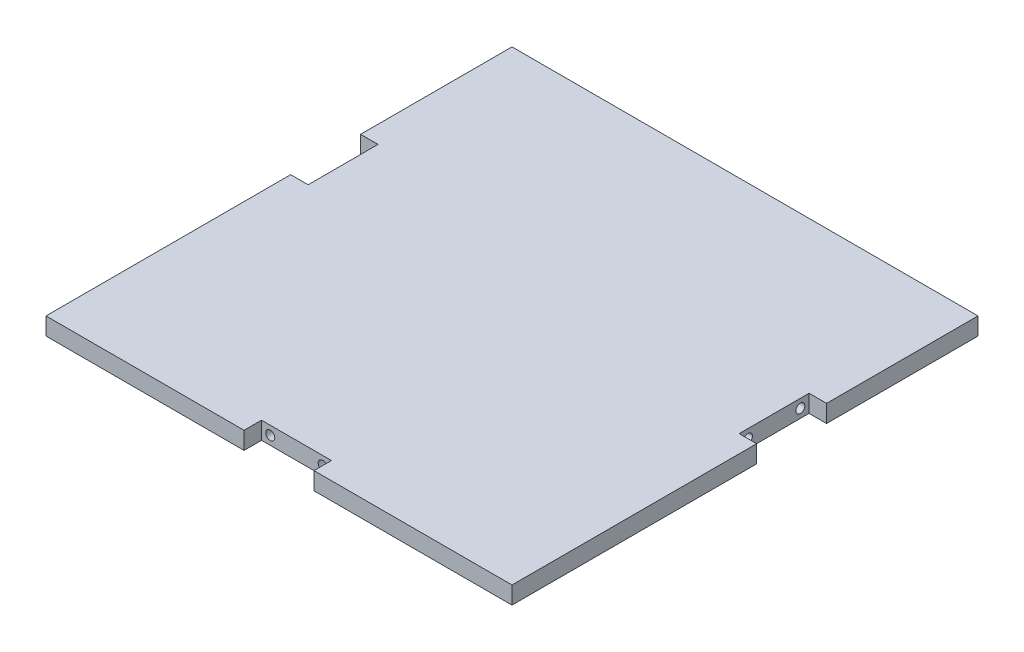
SolidWorks part; units mm, degrees
ref_plane "Front Plane" through (0, 0, 0) normal (0, 0, 1) x (1, 0, 0)
ref_plane "Top Plane" through (0, 0, 0) normal (0, 1, 0) x (1, 0, 0)
ref_plane "Right Plane" through (0, 0, 0) normal (1, 0, 0) x (0, 0, -1)
sketch "Sketch1" plane through (0, 0, 0) normal (0, 1, 0) x (1, 0, 0)
  line L1 (-127, 127) -> (127, 127)
  line L2 (-127, 127) -> (-127, -127)
  line L3 (-127, -127) -> (127, -127)
  line L4 (127, 127) -> (127, -127)
  line L5 (-127, 127) -> (127, -127) construction
  line L6 (-127, -127) -> (127, 127) construction
  point P0 (0, 0)
  dimension "D1" = 254
  dimension "D2" = 254
extrude "Boss-Extrude1" add sketch "Sketch1" along normal blind 9.525
sketch "Sketch7" plane through (0, 9.525, 0) normal (0, 1, 0) x (1, 0, 0)
  line L0 (127, 127) -> (-127, 127) construction
  line L1 (-127, 25.4) -> (-41.0029, 25.4) construction
  line L2 (0, 0) -> (0, -32.6591) construction
  line L3 (-127, 44.45) -> (-117.475, 44.45)
  line L4 (-127, 44.45) -> (-127, 6.35)
  line L5 (-127, 6.35) -> (-117.475, 6.35)
  line L6 (-117.475, 44.45) -> (-117.475, 6.35)
  line L7 (117.475, 44.45) -> (117.475, 6.35)
  line L8 (127, 6.35) -> (117.475, 6.35)
  line L9 (127, 44.45) -> (127, 6.35)
  line L10 (127, 44.45) -> (117.475, 44.45)
  line L11 (0, -127) -> (0, -107.95) construction
  line L13 (-19.05, -127) -> (19.05, -127)
  line L14 (-19.05, -127) -> (-19.05, -117.475)
  line L15 (-127, -127) -> (127, -127) construction
  line L16 (-19.05, -117.475) -> (19.05, -117.475)
  line L17 (19.05, -127) -> (19.05, -117.475)
  point P10 (-117.475, 25.4)
  point P27 (0, -117.475)
  dimension "D1" = 38.1
  dimension "D2" = 9.525
  dimension "D3" = 38.1
  dimension "D4" = 9.525
  dimension "D5" = 82.55
extrude "Cut-Extrude4" cut sketch "Sketch7" against normal through all
sketch3d "3DSketch1"
  line L0 (-117.475, 4.7625, -44.45) -> (-117.475, 4.7625, -6.35) construction
  line L1 (-117.475, 0, -44.45) -> (-117.475, 9.525, -44.45) construction
  line L2 (-117.475, 0, -6.35) -> (-117.475, 9.525, -6.35) construction
  line L3 (-19.05, 4.7625, 117.475) -> (19.05, 4.7625, 117.475) construction
  line L4 (-19.05, 0, 117.475) -> (-19.05, 9.525, 117.475) construction
  line L5 (19.05, 0, 117.475) -> (19.05, 9.525, 117.475) construction
  line L6 (117.475, 4.7625, -6.35) -> (117.475, 4.7625, -44.45) construction
  line L7 (117.475, 0, -6.35) -> (117.475, 9.525, -6.35) construction
  line L8 (117.475, 0, -44.45) -> (117.475, 9.525, -44.45) construction
  point P6 (-117.475, 4.7625, -39.6875)
  point P7 (-117.475, 4.7625, -11.1125)
  point P14 (-14.2875, 4.7625, 117.475)
  point P15 (14.2875, 4.7625, 117.475)
  point P22 (117.475, 4.7625, -11.1125)
  point P23 (117.475, 4.7625, -39.6875)
  dimension "D1" = 4.7625
  dimension "D2" = 4.7625
  dimension "D3" = 4.7625
  dimension "D4" = 4.7625
  dimension "D5" = 4.7625
  dimension "D6" = 4.7625
hole_wizard "#10 (0.1935) Diameter Hole1" positions "Sketch11" profile "Sketch10" hole size "#10" standard "ANSI Inch"
sketch "Sketch11" plane through (117.475, 0, 0) normal (1, 0, 0) x (0, 0, -1)
  point P0 (11.1125, 4.7625)
  point P3 (39.6875, 4.7625)
sketch "Sketch10" plane through (117.475, 4.7625, -11.1125) normal (0, 1, 0) x (0, 0, -1)
  line L0 (0, 0) -> (0, 14.1766)
  line L1 (0, 14.1766) -> (2.4574, 12.7)
  line L2 (2.4574, 12.7) -> (2.4574, 0)
  line L5 (2.4574, 0) -> (0, 0)
  line L10 (0, 14.1766) -> (-2.4575, 12.7) construction
  line L11 (0, -6.35) -> (0, 107.95) construction
  dimension "Hole Dia." = 4.9149
  dimension "Hole Depth" = 12.7
  dimension "Drill Angle" = 118
hole_wizard "#10 (0.1935) Diameter Hole2" positions "Sketch13" profile "Sketch12" hole size "#10" standard "ANSI Inch"
sketch "Sketch13" plane through (0, 0, 117.475) normal (0, 0, 1) x (1, 0, 0)
  point P0 (-14.2875, 4.7625)
  point P3 (14.2875, 4.7625)
sketch "Sketch12" plane through (-14.2875, 4.7625, 117.475) normal (1, 0, 0) x (0, -1, 0)
  line L0 (0, 0) -> (0, 14.1766)
  line L1 (0, 14.1766) -> (2.4574, 12.7)
  line L2 (2.4574, 12.7) -> (2.4574, 0)
  line L5 (2.4574, 0) -> (0, 0)
  line L10 (0, 14.1766) -> (-2.4575, 12.7) construction
  line L11 (0, -6.35) -> (0, 107.95) construction
  dimension "Hole Dia." = 4.9149
  dimension "Hole Depth" = 12.7
  dimension "Drill Angle" = 118
hole_wizard "#10 (0.1935) Diameter Hole3" positions "Sketch15" profile "Sketch14" hole size "#10" standard "ANSI Inch"
sketch "Sketch15" plane through (-117.475, 0, 0) normal (-1, 0, 0) x (0, 0, 1)
  point P0 (-39.6875, 4.7625)
  point P3 (-11.1125, 4.7625)
sketch "Sketch14" plane through (-117.475, 4.7625, -39.6875) normal (0, 1, 0) x (0, 0, 1)
  line L0 (0, 0) -> (0, 14.1766)
  line L1 (0, 14.1766) -> (2.4574, 12.7)
  line L2 (2.4574, 12.7) -> (2.4574, 0)
  line L5 (2.4574, 0) -> (0, 0)
  line L10 (0, 14.1766) -> (-2.4574, 12.7) construction
  line L11 (0, -6.35) -> (0, 107.95) construction
  dimension "Hole Dia." = 4.9149
  dimension "Hole Depth" = 12.7
  dimension "Drill Angle" = 118
